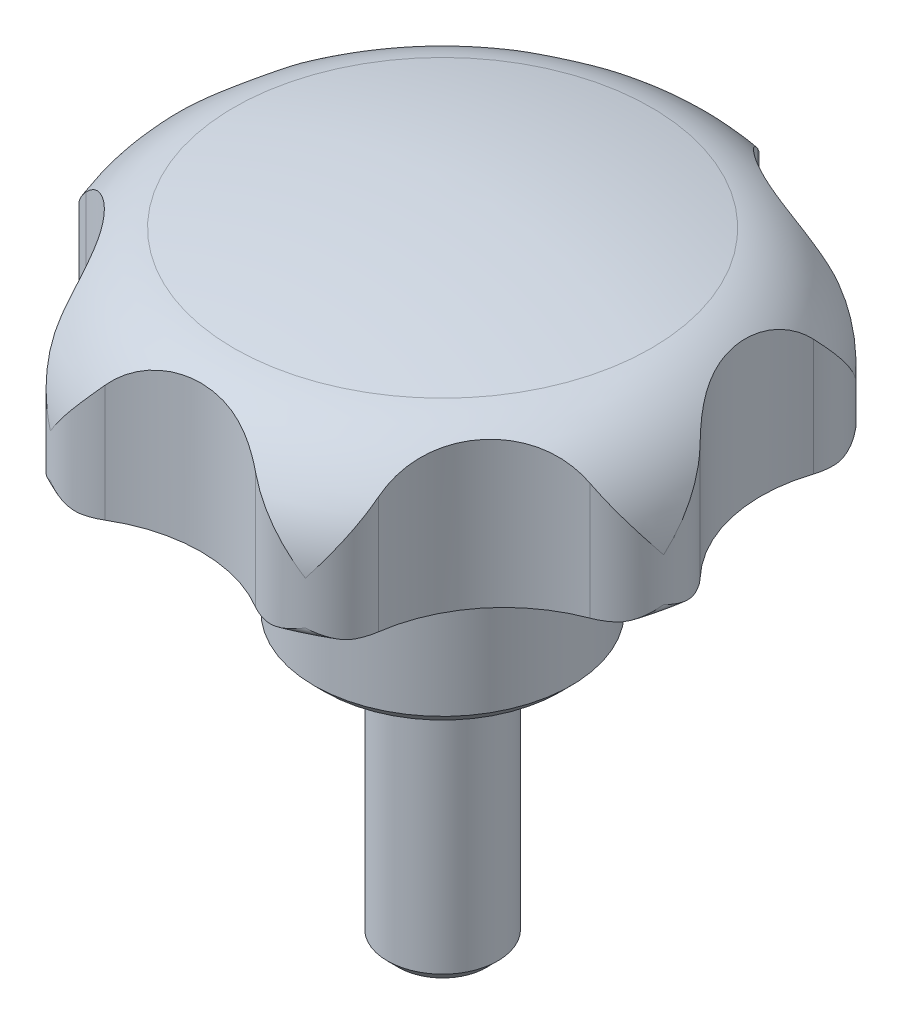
SolidWorks part; units mm, degrees
ref_plane "Face" through (0, 0, 0) normal (0, 0, 1) x (1, 0, 0)
ref_plane "Dessus" through (0, 0, 0) normal (0, 1, 0) x (1, 0, 0)
ref_plane "Droite" through (0, 0, 0) normal (1, 0, 0) x (0, 0, -1)
ref_plane "Plan1" through (0, 0, 0) normal (0, 0, 1) x (1, 0, 0)
sketch "Esquisse1" plane through (0, 0, 0) normal (0, 0, 1) x (1, 0, 0)
  line L0 (16, 12.8486) -> (16, 10.5)
  line L1 (15.5, 10) -> (11.7, 10)
  line L2 (11.2, 10.5) -> (11.2, 16.2792)
  line L3 (8, 16.7333) -> (8, 11)
  line L4 (8, 11) -> (7, 10)
  line L5 (7, 10) -> (7, 0.6)
  line L6 (7, 0.6) -> (6.4, 0)
  line L7 (6.4, 0) -> (0, 0)
  line L8 (0, 0) -> (0, 20)
  line L9 (0, 0) -> (0, 20) construction
  arc A0 (0, 20) -> (11.3636, 18.6916) centre (0, -30) cw
  arc A1 (11.3636, 18.6916) -> (16, 12.8486) centre (10, 12.8486) cw
  arc A2 (16, 10.5) -> (15.5, 10) centre (15.5, 10.5) cw
  arc A3 (11.7, 10) -> (11.2, 10.5) centre (11.7, 10.5) cw
  arc A4 (11.2, 16.2792) -> (10.8126, 16.7663) centre (10.7, 16.2792) ccw
  arc A5 (10.8126, 16.7663) -> (8.5895, 17.2252) centre (0, -30) ccw
  arc A6 (8.5895, 17.2252) -> (8, 16.7333) centre (8.5, 16.7333) ccw
revolve "Révolution1" add sketch "Esquisse1" angle 360 about L9
ref_plane "Plan2" through (0, 0, 0) normal (0, 1, 0) x (-1, 0, 0)
sketch "Esquisse2" plane through (0, 0, 0) normal (0, 1, 0) x (-1, 0, 0)
  circle A0 centre (0, 0) radius 21
  arc A1 (14.8428, 0.8199) -> (15.5988, 3.5603) centre (12.6741, 2.8928) ccw
  arc A2 (15.5988, 3.5603) -> (13.7286, 5.7013) centre (12.6741, 2.8928) ccw
  arc A3 (13.7286, 5.7013) -> (8.6133, 12.1157) centre (16.5407, 13.1908) cw
  arc A4 (8.6133, 12.1157) -> (6.9421, 14.4155) centre (5.6405, 11.7126) ccw
  arc A5 (6.9421, 14.4155) -> (4.1022, 14.2882) centre (5.6405, 11.7126) ccw
  arc A6 (4.1022, 14.2882) -> (-4.1022, 14.2882) centre (0, 21.1564) cw
  arc A7 (-4.1022, 14.2882) -> (-6.9421, 14.4155) centre (-5.6405, 11.7126) ccw
  arc A8 (-6.9421, 14.4155) -> (-8.6133, 12.1157) centre (-5.6405, 11.7126) ccw
  arc A9 (-8.6133, 12.1157) -> (-13.7286, 5.7013) centre (-16.5407, 13.1908) cw
  arc A10 (-13.7286, 5.7013) -> (-15.5988, 3.5603) centre (-12.6741, 2.8928) ccw
  arc A11 (-15.5988, 3.5603) -> (-14.8428, 0.8199) centre (-12.6741, 2.8928) ccw
  arc A12 (-14.8428, 0.8199) -> (-13.0171, -7.1787) centre (-20.6259, -4.7077) cw
  arc A13 (-13.0171, -7.1787) -> (-12.5093, -9.9758) centre (-10.1638, -8.1054) ccw
  arc A14 (-12.5093, -9.9758) -> (-9.8953, -11.0933) centre (-10.1638, -8.1054) ccw
  arc A15 (-9.8953, -11.0933) -> (-2.5035, -14.6531) centre (-9.1794, -19.0612) cw
  arc A16 (-2.5035, -14.6531) -> (0, -16) centre (0, -13) ccw
  arc A17 (0, -16) -> (2.5035, -14.6531) centre (0, -13) ccw
  arc A18 (2.5035, -14.6531) -> (9.8953, -11.0933) centre (9.1794, -19.0612) cw
  arc A19 (9.8953, -11.0933) -> (12.5093, -9.9758) centre (10.1638, -8.1054) ccw
  arc A20 (12.5093, -9.9758) -> (13.0171, -7.1787) centre (10.1638, -8.1054) ccw
  arc A21 (13.0171, -7.1787) -> (14.8428, 0.8199) centre (20.6259, -4.7077) cw
extrude "Enlèv. mat.-Extru.1" cut sketch "Esquisse2" along normal blind 21
ref_plane "Plan3" through (0, 0, 0) normal (0, 1, 0) x (-1, 0, 0)
sketch "Esquisse3" plane through (0, 0, 0) normal (0, 1, 0) x (-1, 0, 0)
  arc A0 (13.0697, 0.5773) -> (13.649, 3.1153) centre (10.7242, 2.4477) ccw
  arc A1 (13.649, 3.1153) -> (12.0259, 5.1506) centre (10.7242, 2.4477) ccw
  arc A2 (12.0259, 5.1506) -> (7.6975, 10.5782) centre (15.4969, 12.3584) cw
  arc A3 (7.6975, 10.5782) -> (6.0744, 12.6136) centre (4.7727, 9.9107) ccw
  arc A4 (6.0744, 12.6136) -> (3.4711, 12.6136) centre (4.7727, 9.9107) ccw
  arc A5 (3.4711, 12.6136) -> (-3.4711, 12.6136) centre (0, 19.8213) cw
  arc A6 (-3.4711, 12.6136) -> (-6.0744, 12.6136) centre (-4.7727, 9.9107) ccw
  arc A7 (-6.0744, 12.6136) -> (-7.6975, 10.5782) centre (-4.7727, 9.9107) ccw
  arc A8 (-7.6975, 10.5782) -> (-12.0259, 5.1506) centre (-15.4969, 12.3584) cw
  arc A9 (-12.0259, 5.1506) -> (-13.649, 3.1153) centre (-10.7242, 2.4477) ccw
  arc A10 (-13.649, 3.1153) -> (-13.0697, 0.5773) centre (-10.7242, 2.4477) ccw
  arc A11 (-13.0697, 0.5773) -> (-11.5249, -6.1908) centre (-19.3244, -4.4107) cw
  arc A12 (-11.5249, -6.1908) -> (-10.9456, -8.7289) centre (-8.6001, -6.8584) ccw
  arc A13 (-10.9456, -8.7289) -> (-8.6001, -9.8584) centre (-8.6001, -6.8584) ccw
  arc A14 (-8.6001, -9.8584) -> (-2.3455, -12.8705) centre (-8.6001, -17.8584) cw
  arc A15 (-2.3455, -12.8705) -> (0, -14) centre (0, -11) ccw
  arc A16 (0, -14) -> (2.3455, -12.8705) centre (0, -11) ccw
  arc A17 (2.3455, -12.8705) -> (8.6001, -9.8584) centre (8.6001, -17.8584) cw
  arc A18 (8.6001, -9.8584) -> (10.9456, -8.7289) centre (8.6001, -6.8584) ccw
  arc A19 (10.9456, -8.7289) -> (11.5249, -6.1908) centre (8.6001, -6.8584) ccw
  arc A20 (11.5249, -6.1908) -> (13.0697, 0.5773) centre (19.3244, -4.4107) cw
  circle A21 centre (0, 0) radius 8
extrude "Enlèv. mat.-Extru.2" cut sketch "Esquisse3" along normal blind 17
ref_plane "Plan4" through (0, 0, 0) normal (0, 0, 1) x (1, 0, 0)
sketch "Esquisse4" plane through (0, 0, 0) normal (0, 0, 1) x (1, 0, 0)
  line L0 (0, 0) -> (3, 0)
  line L1 (3, 0) -> (3, -14.3865)
  line L2 (3, -14.3865) -> (2.3865, -15)
  line L3 (2.3865, -15) -> (0, -15)
  line L4 (0, -15) -> (0, 0)
  line L5 (0, -15) -> (0, 0) construction
revolve "Révolution2" add sketch "Esquisse4" angle 360 about L5
